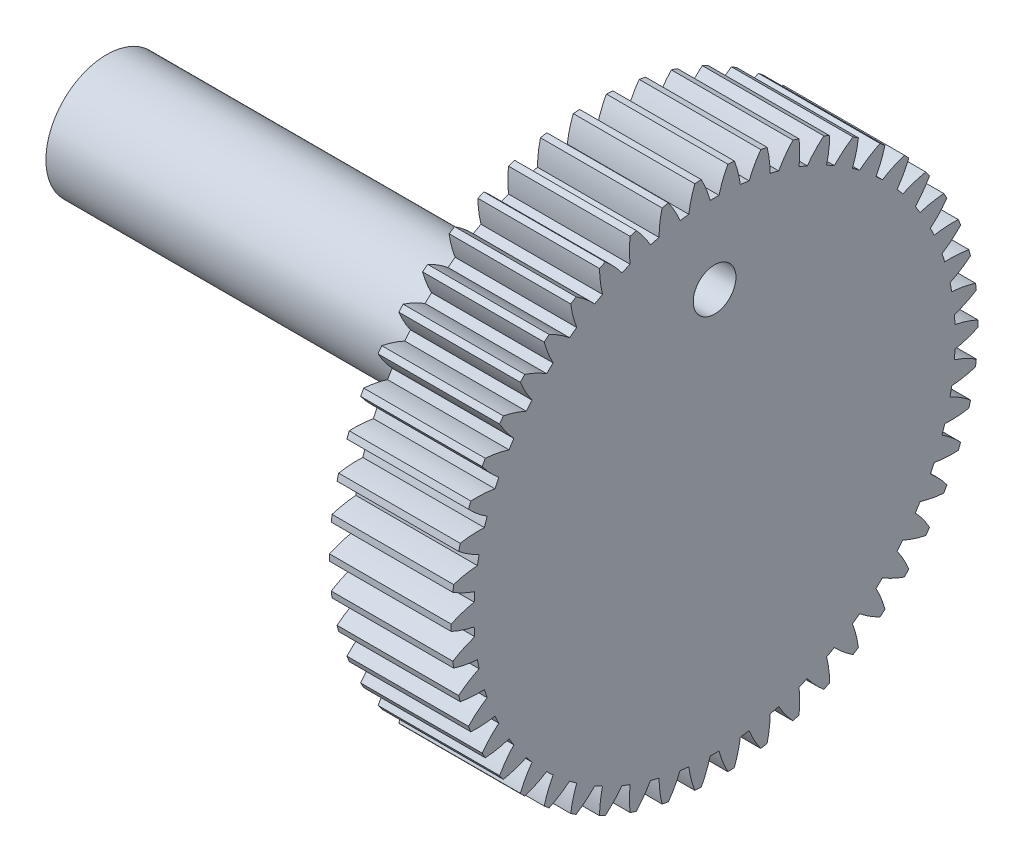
SolidWorks part; units mm, degrees
ref_plane "Plane1" through (0, 0, 0) normal (0, 0, 1) x (1, 0, 0)
ref_plane "Plane2" through (0, 0, 0) normal (0, 1, 0) x (1, 0, 0)
ref_plane "Plane3" through (0, 0, 0) normal (1, 0, 0) x (0, 0, -1)
sketch "HoldingSke" plane through (0, 0, 0) normal (0, 1, 0) x (1, 0, 0)
  line L0 (0, 0) -> (0.6428, -0.766)
  line L1 (-15, 0) -> (100, 0) construction
  line L2 (0, 0) -> (-2.1039, 2.3779)
  line L3 (0, 0) -> (-11.863, 4.5341)
  line L4 (0, 0) -> (5.5511, 6.6156)
  line L5 (0, 0) -> (-46.8476, -17.4728)
  line L6 (0, 0) -> (-9.9476, -6.7116)
  line L7 (-2.1039, 2.3779) -> (8.6586, 51.2059)
  line L8 (-76.2, 54.61) -> (-76.1, 54.61)
  line L9 (-71.009, 38.7566) -> (-53.1078, 45.2721)
  line L10 (-76.2, 71.12) -> (104.1128, 71.12)
  line L11 (0, 0) -> (-12, 0)
  line L12 (-76.2, 101.6) -> (-76.162, 101.6)
  line L13 (24.9733, 27.94) -> (52.9518, 28.4284)
  line L14 (24.9733, 27.94) -> (24.9743, 27.94)
  line L15 (24.9733, 27.94) -> (100.4006, 29.5858)
  line L16 (-63.627, -1) -> (-12.827, -1)
  circle A0 centre (0, 0) radius 0.4
  circle A1 centre (0, 0) radius 23.749
  circle A2 centre (0, 0) radius 37.5
  circle A3 centre (0, 0) radius 0.4
  dimension "MHD" = 47.498
  dimension "Hub_dia" = 75
  dimension "Bore" = 0.8
  dimension "MBD" = 0.8
  dimension "Num_teeth" = 50
  dimension "Pitch_radius" = 180.3128
  dimension "Pitch" = 1
  dimension "Width" = 12
  dimension "Overall_len" = 50
  dimension "Show_teeth" = 50
  dimension "Thickness" = 12
  dimension "OAL" = 50.0001
  dimension "T_dim" = 0.1
  dimension "Ap" = 20
  dimension "H" = 19.05
  dimension "Backlash" = 0.038
  dimension "Addendum_fac" = 1
  dimension "Dedendum_fac" = 1.25
  dimension "Clearance_fac" = 0.25
  dimension "Dedendum_add" = 0.001
  dimension "Module" = 1
sketch "BasProSke" plane through (0, 0, 0) normal (0, 1, 0) x (1, 0, 0)
  line L0 (-10, 0) -> (60, 0) construction
  line L1 (0, 0) -> (0, 26)
  line L2 (0, 0) -> (12, 0)
  line L3 (12, 0) -> (12, 26)
  line L4 (12, 26) -> (0, 26)
  dimension "Diameter" = 52
  dimension "Thickness" = 12
revolve "Base-Revolve" add sketch "BasProSke" angle 360 about L0
sketch "TooCutSke" plane through (0, 0, 0) normal (1, 0, 0) x (0, 0, -1)
  line L1 (0, 0) -> (0, 107) construction
  line L2 (0, 0) -> (-0.8518, 24.9855) construction
  line L3 (0, 0) -> (-3.1382, 49.8807) construction
  line L4 (-0.8518, 24.9855) -> (-1.5691, 24.9404) construction
  arc A0 (0.4377, 23.745) -> (-0.4377, 23.745) centre (0, 0) ccw
  arc A1 (1.3294, 25.9914) -> (-1.3294, 25.9914) centre (0, 0) ccw
  circle A2 centre (0, 0) radius 25 construction
  circle A3 centre (0, 0) radius 23.4923 construction
  arc A4 (-0.4377, 23.745) -> (-1.3294, 25.9914) centre (-10.1099, 21.2056) ccw
  arc A5 (1.3294, 25.9914) -> (0.4377, 23.745) centre (10.1099, 21.2056) ccw
  dimension "Root_dia" = 47.498
  dimension "Overcut_dia" = 52.0508
  dimension "Pitch_dia" = 50
  dimension "Base_dia" = 46.9846
  dimension "Flank_rad" = 10
  dimension "Half_ang" = 3.6
  dimension "Half_CT" = 0.7188
extrude "ToothCut" cut sketch "TooCutSke" along normal through all
fillet "Breaks" [suppressed] radius 0.02
fillet "RootFillets" [suppressed] radius 0.251
pattern_circular "TeethCuts" count 50 every 7.2 about axis through (-10, 0, 0) along (1, 0, 0) of "ToothCut", "RootFillets", "Breaks"
sketch "HubNeaOneSke" plane through (0, 0, 0) normal (-1, 0, 0) x (0, 0, 1)
  circle A0 centre (0, 0) radius 23.749
  dimension "Diameter" = 47.498
extrude "HubNearOne" [suppressed] add sketch "HubNeaOneSke" along normal blind 38.0001
sketch "HubNeaBotSke" plane through (0, 0, 0) normal (-1, 0, 0) x (0, 0, 1)
  circle A0 centre (0, 0) radius 23.749
  dimension "Diameter" = 47.498
extrude "HubNearBoth" [suppressed] add sketch "HubNeaBotSke" along normal blind 19
ref_plane "FarPln" through (12, 0, 0) normal (1, 0, 0) x (0, 0, -1)
sketch "HubFarSke" plane through (12, 0, 0) normal (1, 0, 0) x (0, 0, -1)
  circle A0 centre (0, 0) radius 23.749
  dimension "Diameter" = 47.498
extrude "HubFar" [suppressed] add sketch "HubFarSke" along normal blind 19
sketch "BorSke" plane through (0, 0, 0) normal (1, 0, 0) x (0, 0, -1)
  circle A0 centre (0, 0) radius 0.4
  dimension "Diameter" = 0.8
extrude "Bore" cut sketch "BorSke" along normal mid plane 100.0001
sketch "KeySke" plane through (0, 0, 0) normal (1, 0, 0) x (0, 0, -1)
  line L0 (-0.05, 0) -> (-0.05, 0.5)
  line L1 (-0.05, 0.5) -> (0.05, 0.5)
  line L2 (0.05, 0.5) -> (0.05, 0)
  line L3 (0, 0) -> (0, 34) construction
  line L4 (-0.05, 0) -> (0.05, 0)
  dimension "Offset" = 0.5
  dimension "Width" = 0.1
extrude "Keyway" [suppressed] cut sketch "KeySke" along normal mid plane 100.0001
pattern_circular "Keyway2" [suppressed] count 2 every 90 about axis through (-10, 0, 0) along (1, 0, 0)
sketch "Esquisse1" plane through (12, 0, 0) normal (1, 0, 0) x (0, 0, -1)
  circle A0 centre (0, 0) radius 6
extrude "Extrusion1" add sketch "Esquisse1" against normal blind 60
sketch "Esquisse2" plane through (12, 0, 0) normal (1, 0, 0) x (0, 0, -1)
  circle A0 centre (0, 15.922) radius 2.1076
extrude "Enlèv. mat.-Extru.1" cut sketch "Esquisse2" against normal through all
sketch "Esquisse3" plane through (0, 0, 0) normal (-1, 0, 0) x (0, 0, 1)
  text T0 "2"
extrude "Enlèv. mat.-Extru.2" cut sketch "Esquisse3" against normal blind 1
equation "' \"Module@HoldingSke\" = 6.35"
equation "' \"Num_teeth@HoldingSke\" = 12"
equation "' \"Ap@HoldingSke\" =  20"
equation "' \"Width@HoldingSke\" = 0.5 * 25.4"
equation "' \"Hub_dia@HoldingSke\"= 1 * 25.4"
equation "' \"Overall_len@HoldingSke\" = 1.0 * 25.4"
equation "' \"Bore@HoldingSke\" = 0.75 * 25.4"
equation "' \"T_dim@HoldingSke\" = 0.1 * 25.4"
equation "' \"Width@KeySke\" = 0.25 * 25.4"
equation "' \"Show_teeth@HoldingSke\" = 13"
equation "' \"Backlash@HoldingSke\" = 0.009 * 25.4"
equation "' \"Addendum_fac@HoldingSke\" = 1.0"
equation "' \"Dedendum_fac@HoldingSke\" = 1.25"
equation "' \"Dedendum_add@HoldingSke\" = 0.00005 * 25.4"
equation "' \"Clearance_fac@HoldingSke\" = 0.25"
equation "\"Pitch@HoldingSke\" = 1 / \"Module@HoldingSke\""
equation "\"Overcut_dia@TooCutSke\" = (\"Num_teeth@HoldingSke\" + 2 * \"Addendum_fac@HoldingSke\") / \"Pitch@HoldingSke\" + 0.002 * 25.4"
equation "\"Pitch_dia@TooCutSke\" = \"Num_teeth@HoldingSke\" / \"Pitch@HoldingSke\""
equation "\"Base_dia@TooCutSke\" = \"Num_teeth@HoldingSke\" / \"Pitch@HoldingSke\" * cos((\"Ap@HoldingSke\"  * 3.14159265 / 180))"
equation "\"Root_dia@TooCutSke\" = (\"Num_teeth@HoldingSke\" + 2) / \"Pitch@HoldingSke\" - 2 * (\"Addendum_fac@HoldingSke\" + \"Dedendum_fac@HoldingSke\") / \"Pitch@HoldingSke\" - \"Dedendum_add@HoldingSke\" * 2"
equation "\"Half_ang@TooCutSke\" = 180 / \"Num_teeth@HoldingSke\""
equation "\"Half_CT@TooCutSke\" = \"Num_teeth@HoldingSke\" / \"Pitch@HoldingSke\" * sin((3.14159265 / 2 / \"Num_teeth@HoldingSke\")) / 2 - 7 * \"Backlash@HoldingSke\" / 4"
equation "\"Flank_rad@TooCutSke\" = \"Num_teeth@HoldingSke\" / \"Pitch@HoldingSke\" / 5"
equation "\"Radius@RootFillets\" = \"Clearance_fac@HoldingSke\" / \"Pitch@HoldingSke\" + \"Dedendum_add@HoldingSke\""
equation "\"Break_rad@Breaks\" = 0.02 / \"Pitch@HoldingSke\""
equation "\"Thickness@HoldingSke\" = \"Width@HoldingSke\""
equation "\"OAL@HoldingSke\" = \"Thickness@HoldingSke\""
equation "\"MHD@HoldingSke\" = (\"Num_teeth@HoldingSke\" + 2) / \"Pitch@HoldingSke\" - 2 * (\"Addendum_fac@HoldingSke\" + \"Dedendum_fac@HoldingSke\")  / \"Pitch@HoldingSke\" - \"Dedendum_add@HoldingSke\" * 2"
equation "\"MBD@HoldingSke\" = (\"Num_teeth@HoldingSke\" + 2) / \"Pitch@HoldingSke\" - 2 * (\"Addendum_fac@HoldingSke\" + \"Dedendum_fac@HoldingSke\")  / \"Pitch@HoldingSke\" - \"Dedendum_add@HoldingSke\" * 2 - 0.002 * 25.4"
equation "\"MHD@HoldingSke\" = ((sgn( \"MHD@HoldingSke\" - \"Hub_dia@HoldingSke\" )-1)*( \"MHD@HoldingSke\" - \"Hub_dia@HoldingSke\" ))/-2+ \"Hub_dia@HoldingSke\""
equation "\"MBD@HoldingSke\" = ((sgn( \"MBD@HoldingSke\" - \"Bore@HoldingSke\" )-1)*( \"MBD@HoldingSke\" - \"Bore@HoldingSke\" ))/-2+ \"Bore@HoldingSke\""
equation "\"OAL@HoldingSke\" = ((sgn( \"OAL@HoldingSke\" - \"Overall_len@HoldingSke\" )+1)*( \"OAL@HoldingSke\" - \"Overall_len@HoldingSke\" ))/2 + \"Overall_len@HoldingSke\" + 0.000002 * 25.4"
equation "\"Num_teeth@TeethCuts\" = int( \"Show_teeth@HoldingSke\" ) + 1"
equation "\"Num_teeth@TeethCuts\" = ((sgn( \"Num_teeth@TeethCuts\" - \"Num_teeth@HoldingSke\" )-1)*( \"Num_teeth@TeethCuts\" - \"Num_teeth@HoldingSke\" ))/-2+ \"Num_teeth@HoldingSke\""
equation "\"Num_teeth@TeethCuts\" = ((sgn( \"Num_teeth@TeethCuts\" - 2.0)+1)*( \"Num_teeth@TeethCuts\" - 2.0))/2 +2.0"
equation "\"Angle@TeethCuts\" = 360.0 / \"Num_teeth@HoldingSke\""
equation "\"Diameter@BasProSke\" = (\"Num_teeth@HoldingSke\" + 2 * \"Addendum_fac@HoldingSke\") / \"Pitch@HoldingSke\""
equation "\"Thickness@BasProSke\"  = \"Thickness@HoldingSke\""
equation "' \"Fillet_rad@BasProSke\" =  \"Thickness@HoldingSke\" * 0.05"
equation "\"MHD@HoldingSke\" = ((sgn( \"MHD@HoldingSke\" - \"Root_dia@TooCutSke\" )-1)*( \"MHD@HoldingSke\" - \"Root_dia@TooCutSke\" ))/-2+ \"Root_dia@TooCutSke\""
equation "\"Diameter@HubNeaOneSke\" = \"MHD@HoldingSke\""
equation "\"Length@HubNearOne\" = \"OAL@HoldingSke\" - \"Thickness@BasProSke\""
equation "\"Diameter@HubNeaBotSke\" = \"MHD@HoldingSke\""
equation "\"Length@HubNearBoth\" = ( \"OAL@HoldingSke\" - \"Thickness@BasProSke\" ) / 2.0"
equation "\"Thickness@FarPln\" = \"Thickness@BasProSke\""
equation "\"Diameter@HubFarSke\" = \"MHD@HoldingSke\""
equation "\"Length@HubFar\" = ( \"OAL@HoldingSke\" - \"Thickness@BasProSke\" ) / 2.0"
equation "\"Diameter@BorSke\" = \"MBD@HoldingSke\""
equation "\"D1@Bore\" = \"OAL@HoldingSke\" * 2.0"
equation "\"D1@Keyway\" = \"OAL@HoldingSke\" * 2.0"
equation "\"Offset@KeySke\" = \"T_dim@HoldingSke\" + \"MBD@HoldingSke\" / 2.0"
